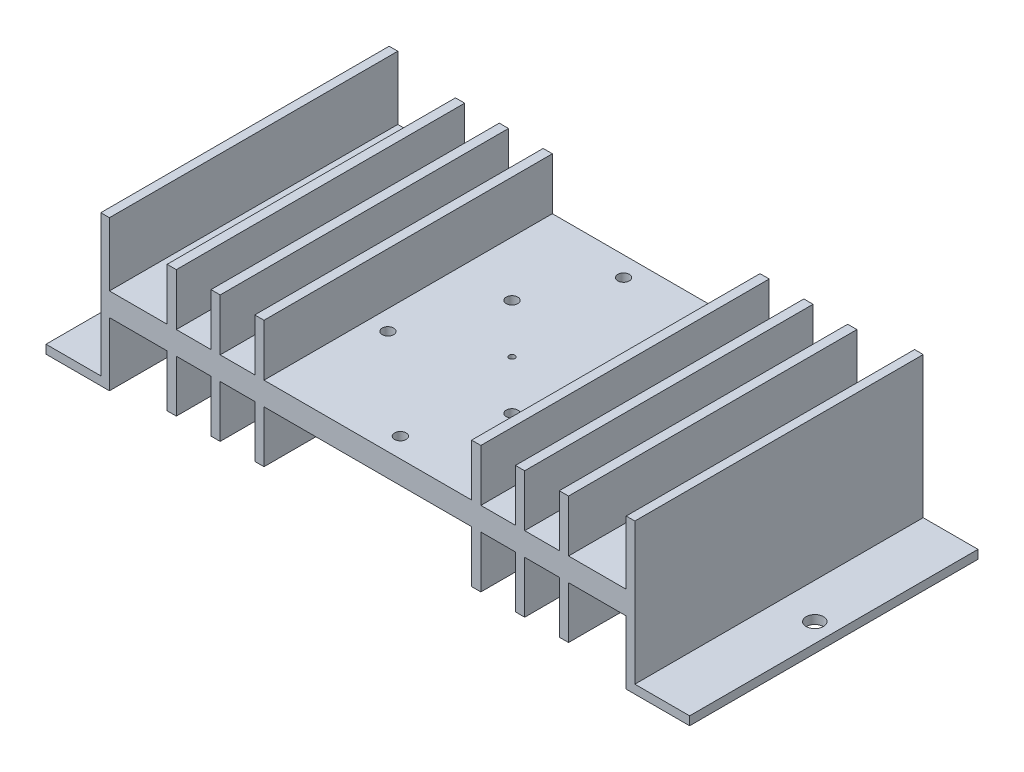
SolidWorks part; units mm, degrees
ref_plane "Plan de face" through (0, 0, 0) normal (0, 0, 1) x (1, 0, 0)
ref_plane "Plan de dessus" through (0, 0, 0) normal (0, 1, 0) x (1, 0, 0)
ref_plane "Plan de droite" through (0, 0, 0) normal (1, 0, 0) x (0, 0, -1)
sketch "Esquisse1" plane through (0, 0, 0) normal (0, 0, 1) x (1, 0, 0)
  line L0 (-52.3826, -2) -> (-41.3826, -2)
  line L1 (-41.3826, -2) -> (-41.3826, 9)
  line L2 (-41.3826, 9) -> (-31.3826, 9)
  line L3 (-31.3826, 9) -> (-31.3826, 0)
  line L4 (-31.3826, 0) -> (-29.7826, 0)
  line L5 (-29.7826, 0) -> (-29.7826, 9)
  line L6 (-29.7826, 9) -> (-23.7826, 9)
  line L7 (-23.7826, 9) -> (-23.7826, 0)
  line L8 (-23.7826, 0) -> (-22.1826, 0)
  line L9 (-22.1826, 0) -> (-22.1826, 9)
  line L10 (-22.1826, 9) -> (-16.1826, 9)
  line L11 (-16.1826, 9) -> (-16.1826, 0)
  line L12 (-16.1826, 0) -> (-14.5826, 0)
  line L13 (-14.5826, 0) -> (-14.5826, 9)
  line L14 (-14.5826, 9) -> (21.4174, 9)
  line L15 (3.4174, 9) -> (3.4174, 13)
  line L16 (21.4174, 13) -> (-14.5826, 13)
  line L17 (-14.5826, 13) -> (-14.5826, 22)
  line L18 (-14.5826, 22) -> (-16.1826, 22)
  line L19 (-16.1826, 22) -> (-16.1826, 13)
  line L20 (-16.1826, 13) -> (-22.1826, 13)
  line L21 (-22.1826, 13) -> (-22.1826, 22)
  line L22 (-22.1826, 22) -> (-23.7826, 22)
  line L23 (-23.7826, 22) -> (-23.7826, 13)
  line L24 (-23.7826, 13) -> (-29.7826, 13)
  line L25 (-29.7826, 13) -> (-29.7826, 22)
  line L26 (-29.7826, 22) -> (-31.3826, 22)
  line L27 (-31.3826, 22) -> (-31.3826, 13)
  line L28 (-31.3826, 13) -> (-41.3826, 13)
  line L29 (-41.3826, 13) -> (-41.3826, 24)
  line L30 (-41.3826, 24) -> (-42.8826, 24)
  line L31 (-42.8826, 24) -> (-42.8826, -0.5)
  line L32 (-42.8826, -0.5) -> (-52.3826, -0.5)
  line L33 (-52.3826, -0.5) -> (-52.3826, -2)
  line L34 (59.2174, -0.5) -> (59.2174, -2)
  line L35 (49.7174, -0.5) -> (59.2174, -0.5)
  line L36 (49.7174, 24) -> (49.7174, -0.5)
  line L37 (48.2174, 24) -> (49.7174, 24)
  line L38 (48.2174, 13) -> (48.2174, 24)
  line L39 (38.2174, 13) -> (48.2174, 13)
  line L40 (38.2174, 22) -> (38.2174, 13)
  line L41 (36.6174, 22) -> (38.2174, 22)
  line L42 (36.6174, 13) -> (36.6174, 22)
  line L43 (30.6174, 13) -> (36.6174, 13)
  line L44 (30.6174, 22) -> (30.6174, 13)
  line L45 (29.0174, 22) -> (30.6174, 22)
  line L46 (29.0174, 13) -> (29.0174, 22)
  line L47 (23.0174, 13) -> (29.0174, 13)
  line L48 (23.0174, 22) -> (23.0174, 13)
  line L49 (21.4174, 22) -> (23.0174, 22)
  line L50 (21.4174, 13) -> (21.4174, 22)
  line L51 (21.4174, 0) -> (21.4174, 9)
  line L52 (23.0174, 0) -> (21.4174, 0)
  line L53 (23.0174, 9) -> (23.0174, 0)
  line L54 (29.0174, 9) -> (23.0174, 9)
  line L55 (29.0174, 0) -> (29.0174, 9)
  line L56 (30.6174, 0) -> (29.0174, 0)
  line L57 (30.6174, 9) -> (30.6174, 0)
  line L58 (36.6174, 9) -> (30.6174, 9)
  line L59 (36.6174, 0) -> (36.6174, 9)
  line L60 (38.2174, 0) -> (36.6174, 0)
  line L61 (38.2174, 9) -> (38.2174, 0)
  line L62 (48.2174, 9) -> (38.2174, 9)
  line L63 (48.2174, -2) -> (48.2174, 9)
  line L64 (59.2174, -2) -> (48.2174, -2)
  dimension "D1" = 4
  dimension "D2" = 4
  dimension "D3" = 4
  dimension "D4" = 4
  dimension "D5" = 1.6
  dimension "D6" = 1.6
  dimension "D7" = 1.6
  dimension "D8" = 6
  dimension "D9" = 6
  dimension "D10" = 18
  dimension "D11" = 10
  dimension "D12" = 1.5
  dimension "D13" = 11
  dimension "D14" = 0
  dimension "D15" = 0
  dimension "D16" = 0
  dimension "D17" = 9
  dimension "D18" = 9
  dimension "D19" = 9
  dimension "D20" = 9
  dimension "D21" = 1.5
  dimension "D23" = 11
extrude "Boss.-Extru.1" add sketch "Esquisse1" along normal blind 50 contours L14 L51 L52 L53 L54 L55 L56 L57 L58 L59 L60 L61 L62 L63 L64 L34 L35 L36 L37 L38 L39 L40 L41 L42 L43 L44 L45 L46 L47 L48 L49 L50 L16 L17 L18 L19 L20 L21 L22 L23 L24 L25 L26 L27 L28 L29 L30 L31 L32 L33 L0 L1 L2 L3 L4 L5 L6 L7 L8 L9 L10 L11 L12 L13
sketch "Esquisse3" plane through (0, -0.5, 0) normal (0, 1, 0) x (1, 0, 0)
  line L1 (-14.5826, 0) -> (21.4174, 0) construction
  circle A0 centre (-49.0826, -25) radius 1.5
  circle A1 centre (55.9174, -25) radius 1.5
  point P0 (3.4174, 0)
  point P6 (3.4174, 0)
  dimension "D1" = 52.5
  dimension "D2" = 52.5
extrude "Enlèv. mat.-Extru.1" cut sketch "Esquisse3" against normal blind 10
sketch "Esquisse4" plane through (0, 13, 0) normal (0, 1, 0) x (1, 0, 0)
  line L0 (3.4174, -53.1567) -> (3.4174, -17.1843) construction
  line L1 (-13.0419, -25) -> (6.8355, -25) construction
  line L2 (3.4174, -25) -> (-6.5125, -15.0701) construction
  line L3 (3.4174, -25) -> (10.8504, -17.567) construction
  line L4 (1.2327, -10.2141) -> (-7.625, -19.0719) construction
  circle A0 centre (5.6474, -46.59) radius 1
  circle A1 centre (-11.1726, -31.925) radius 1
  circle A2 centre (18.0074, -18.09) radius 1
  circle A3 centre (1.1874, -3.425) radius 1
  circle A4 centre (3.4174, -25) radius 0.5
  circle A5 centre (-5.0678, -16.5147) radius 1
  circle A6 centre (11.9027, -33.4853) radius 1
  dimension "D1" = 45
  dimension "D2" = 90
  dimension "D3" = 12
extrude "Enlèv. mat.-Extru.2" cut sketch "Esquisse4" against normal blind 4
